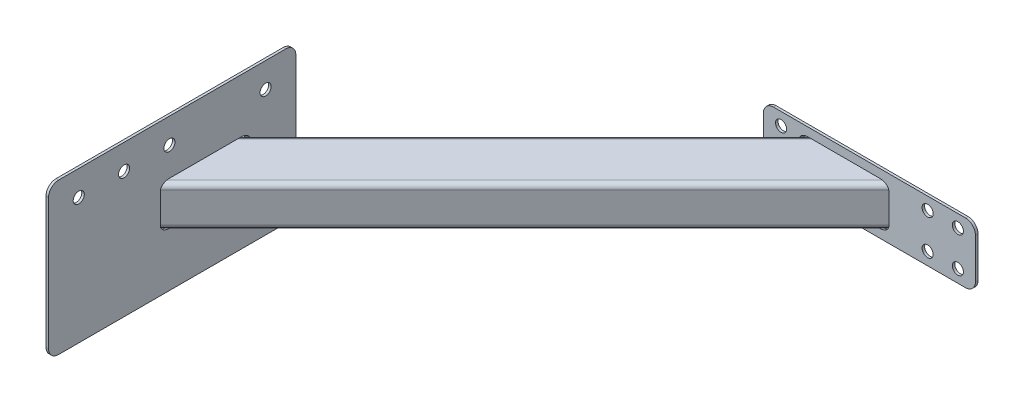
SolidWorks part; units mm, degrees
ref_plane "Płaszczyzna przednia" through (0, 0, 0) normal (0, 0, 1) x (1, 0, 0)
ref_plane "Płaszczyzna górna" through (0, 0, 0) normal (0, 1, 0) x (1, 0, 0)
ref_plane "Płaszczyzna prawa" through (0, 0, 0) normal (1, 0, 0) x (0, 0, -1)
sketch "Szkic1" plane through (0, 0, 0) normal (0, 1, 0) x (1, 0, 0)
  line L0 (758.8942, 1073.417) -> (758.8942, 1016.417) construction
  line L1 (8.8942, 1016.417) -> (8.8942, -1073.6548) construction
  line L2 (-846.1488, 1016.417) -> (846.1488, 1016.417) construction
  line L3 (758.8942, 1016.417) -> (8.8942, 266.417) construction
  dimension "D1" = 45
  dimension "D2" = 750
ref_plane "Płaszczyzna1" through (0, 0, -1016.417) normal (0, 0, 1) x (1, 0, 0)
ref_plane "Płaszczyzna2" through (8.8942, 0, 0) normal (-1, 0, 0) x (0, 0, 1)
sketch "Szkic3" plane through (0, 0, 0) normal (0, 1, 0) x (1, 0, 0)
  line L0 (874.155, 1237.7438) -> (-771.1848, -407.5961)
  line L2 (758.8942, 1016.417) -> (8.8942, 266.417) construction
  dimension "D1" = 75
other "Tube (rectangular) 120 X 80 X 5.0(1)"
ref_plane "Płaszczyzna3" through (874.155, 0, -1237.7438) normal (-0.7071, 0, 0.7071) x (0, 1, 0)
sketch "Sketch11" plane through (874.155, 0, -1237.7438) normal (-0.7071, 0, 0.7071) x (0, 1, 0)
  line L0 (-30, -55) -> (30, -55)
  line L1 (-35, -50) -> (-35, 50)
  line L2 (30, 55) -> (-30, 55)
  line L3 (35, 50) -> (35, -50)
  line L4 (-30, -60) -> (30, -60)
  line L5 (-40, -50) -> (-40, 50)
  line L6 (30, 60) -> (-30, 60)
  line L7 (40, 50) -> (40, -50)
  line L8 (-40, 0) -> (-35, 0) construction
  line L9 (-35, 0) -> (35, 0) construction
  line L10 (35, 0) -> (40, 0) construction
  line L11 (0, 60) -> (0, 55) construction
  line L12 (0, 55) -> (0, -55) construction
  line L13 (0, -55) -> (0, -60) construction
  arc A0 (40, 50) -> (30, 60) centre (30, 50) ccw
  arc A1 (30, -60) -> (40, -50) centre (30, -50) ccw
  arc A2 (-40, -50) -> (-30, -60) centre (-30, -50) ccw
  arc A3 (-30, 60) -> (-40, 50) centre (-30, 50) ccw
  arc A4 (-30, 55) -> (-35, 50) centre (-30, 50) ccw
  arc A5 (35, 50) -> (30, 55) centre (30, 50) ccw
  arc A6 (30, -55) -> (35, -50) centre (30, -50) ccw
  arc A7 (-35, -50) -> (-30, -55) centre (-30, -50) ccw
  point P6 (-40, 60)
  point P33 (-40, -60)
  point P34 (40, -60)
  point P36 (40, 60)
  point P37 (0, 0)
  dimension "D1" = 10
  dimension "Thickness" = 5
  dimension "V_leg" = 120
  dimension "H_leg" = 80
other "Przytnij/Wydłuż1"
sketch "Szkic4" plane through (0, 0, 0) normal (0, 1, 0) x (1, 0, 0)
  line L0 (487.9754, 1013.917) -> (908.8942, 1013.917)
  line L1 (11.3942, 557.3358) -> (11.3942, 66.417)
  line L2 (8.8942, 1016.417) -> (8.8942, -1073.6548) construction
  line L3 (-846.1488, 1016.417) -> (846.1488, 1016.417) construction
  dimension "D1" = 2.5
  dimension "D2" = 2.5
  dimension "D3" = 80
  dimension "D4" = 150
  dimension "D5" = 100
  dimension "D6" = 200
ref_plane "Płaszczyzna4" through (487.9754, 0, -1013.917) normal (1, 0, 0) x (0, 0, -1)
other "Blacha 120x5 - configured BLACHA 120X5(1)"
ref_plane "Płaszczyzna5" through (487.9754, 0, -1013.917) normal (1, 0, 0) x (0, 1, 0)
sketch "Szkic11" plane through (487.9754, 0, -1013.917) normal (1, 0, 0) x (0, 1, 0)
  line L1 (-60, 2.5) -> (60, 2.5)
  line L2 (-60, 2.5) -> (-60, -2.5)
  line L3 (-60, -2.5) -> (60, -2.5)
  line L4 (60, 2.5) -> (60, -2.5)
  line L5 (-60, 2.5) -> (60, -2.5) construction
  line L6 (-60, -2.5) -> (60, 2.5) construction
  point P0 (0, 0)
  point P6 (0, 0)
  dimension "D1" = 120
  dimension "D2" = 5
other "Blacha 300x5 - configured BLACHA 300X5(1)"
ref_plane "Płaszczyzna6" through (11.3942, 0, -557.3358) normal (0, 0, 1) x (0, 1, 0)
sketch "Szkic12" plane through (11.3942, 0, -557.3358) normal (0, 0, 1) x (0, 1, 0)
  line L1 (-150, 2.5) -> (150, 2.5)
  line L2 (-150, 2.5) -> (-150, -2.5)
  line L3 (-150, -2.5) -> (150, -2.5)
  line L4 (150, 2.5) -> (150, -2.5)
  line L5 (-150, 2.5) -> (150, -2.5) construction
  line L6 (-150, -2.5) -> (150, 2.5) construction
  point P0 (0, 0)
  point P6 (0, 0)
  dimension "D1" = 300
  dimension "D2" = 5
other "Przytnij/Wydłuż2"
other "Przytnij/Wydłuż3"
fillet "Zaokrąglenie1" radius 20 4 edges at (11.3942, -150, -66.417) (11.3942, 150, -66.417) (11.3942, -150, -557.3358) (11.3942, 150, -557.3358)
fillet "Zaokrąglenie2" radius 20 4 edges at (487.9754, 60, -1013.917) (487.9754, -60, -1013.917) (908.8942, 60, -1013.917) (908.8942, -60, -1013.917)
sketch "Szkic13" plane through (13.8942, 0, 0) normal (1, 0, 0) x (0, 0, -1)
  line L1 (557.3358, 0) -> (66.417, 0) construction
  line L2 (66.417, -130) -> (66.417, 130) construction
  line L3 (557.3358, -130) -> (557.3358, 130) construction
  circle A0 centre (216.417, 100) radius 11
  circle A1 centre (126.417, 100) radius 11
  circle A4 centre (-1123.583, -100) radius 11
  circle A5 centre (-1033.583, -100) radius 11
  circle A6 centre (497.3358, 100) radius 11
  circle A7 centre (497.3358, -100) radius 11
  circle A8 centre (306.417, 100) radius 11
  circle A9 centre (-943.583, -100) radius 11
  dimension "D1" = 22
  dimension "D2" = 100
  dimension "D3" = 100
  dimension "D4" = 60
  dimension "D5" = 90
  dimension "D6" = 60
  dimension "D7" = 2
extrude "Wytnij-wyciągnięcie1" cut sketch "Szkic13" against normal blind 10
sketch "Szkic14" plane through (0, 0, -1016.417) normal (0, 0, -1) x (-1, 0, 0)
  line L0 (-888.8942, 60) -> (-507.9754, 60) construction
  line L1 (-888.8942, -60) -> (-507.9754, -60) construction
  line L2 (-487.9754, -40) -> (-487.9754, 40) construction
  line L3 (-908.8942, -40) -> (-908.8942, 40) construction
  circle A0 centre (-873.8942, 35) radius 11
  circle A1 centre (-813.8942, 35) radius 11
  circle A2 centre (-873.8942, -35) radius 11
  circle A3 centre (-813.8942, -35) radius 11
  circle A4 centre (-522.9754, 35) radius 11
  circle A5 centre (-522.9754, -35) radius 11
  dimension "D3" = 25
  dimension "D4" = 22
  dimension "D5" = 35
  dimension "D6" = 35
  dimension "D1" = 60
  dimension "D2" = 25
extrude "Wytnij-wyciągnięcie2" cut sketch "Szkic14" against normal blind 20
sketch "Szkic17" plane through (8.8942, 0, 0) normal (-1, 0, 0) x (0, 0, 1)
  line L0 (-461.5784, 7.3343) -> (-466.5784, 7.3343) construction
  line L1 (-452.0784, 53) -> (-297.8875, 53)
  line L2 (-464.0784, 41) -> (-464.0784, -41)
  line L3 (-452.0784, -53) -> (-297.8875, -53)
  line L4 (-285.8875, 41) -> (-285.8875, -41)
  line L7 (-461.5784, 30) -> (-461.5784, -30) construction
  line L8 (-466.5784, -30) -> (-466.5784, 30) construction
  line L9 (-288.3875, -4.606) -> (-283.3875, -4.606) construction
  line L10 (-288.3875, 30) -> (-288.3875, -30) construction
  line L11 (-283.3875, -30) -> (-283.3875, 30) construction
  line L12 (758.2265, 1.2143) -> (763.3163, 0) construction
  line L13 (562.6841, 50.8519) -> (972.6289, 50.8519)
  line L14 (550.6841, 38.8519) -> (550.6841, -38.718)
  line L15 (562.6841, -50.718) -> (972.6289, -50.718)
  line L16 (984.6289, 38.8519) -> (984.6289, -38.718)
  line L17 (753.2583, -0.0612) -> (757.9793, -1.2733) construction
  line L18 (753.2583, -0.0612) -> (758.2265, 1.2143) construction
  line L19 (757.9793, -1.2733) -> (763.3163, 0) construction
  arc A0 (-297.8875, -53) -> (-285.8875, -41) centre (-297.8875, -41) ccw
  arc A1 (-297.8875, 53) -> (-285.8875, 41) centre (-297.8875, 41) cw
  arc A2 (-464.0784, -41) -> (-452.0784, -53) centre (-452.0784, -41) ccw
  arc A3 (-452.0784, 53) -> (-464.0784, 41) centre (-452.0784, 41) ccw
  arc A4 (550.6841, -38.718) -> (562.6841, -50.718) centre (562.6841, -38.718) ccw
  arc A5 (562.6841, 50.8519) -> (550.6841, 38.8519) centre (562.6841, 38.8519) ccw
  arc A6 (972.6289, 50.8519) -> (984.6289, 38.8519) centre (972.6289, 38.8519) cw
  arc A7 (972.6289, -50.718) -> (984.6289, -38.718) centre (972.6289, -38.718) ccw
  point P4 (763.3163, 0)
  point P33 (753.2583, -0.0612)
equation "\"D3@Szkic17\"=\"D1@Szkic17\"/2"
equation "\"D4@Szkic17\"=\"D3@Szkic17\""
